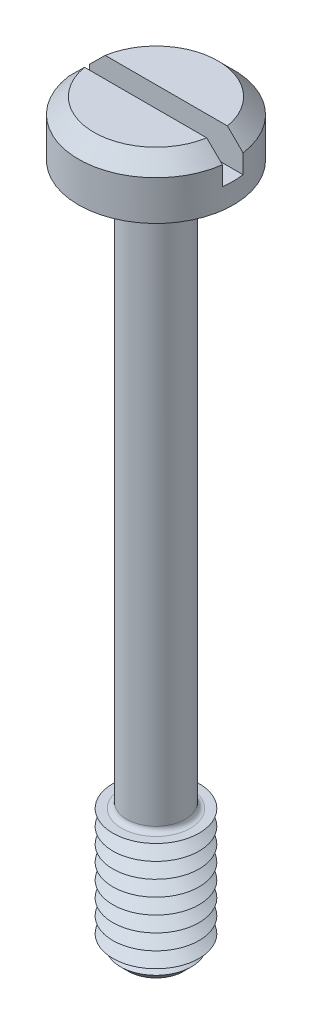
SolidWorks part; units mm, degrees
ref_plane "Front Plane" through (0, 0, 0) normal (0, 0, 1) x (1, 0, 0)
ref_plane "Top Plane" through (0, 0, 0) normal (0, 1, 0) x (1, 0, 0)
ref_plane "Right Plane" through (0, 0, 0) normal (1, 0, 0) x (0, 0, -1)
sketch "Sketch1" plane through (0, 0, 0) normal (0, 1, 0) x (1, 0, 0)
  circle A0 centre (0, 0) radius 2.25
  dimension "D1" = 4.5
extrude "Boss-Extrude1" add sketch "Sketch1" along normal blind 1.6
sketch "Sketch2" plane through (0, 0, 0) normal (0, -1, 0) x (1, 0, 0)
  circle A0 centre (0, 0) radius 0.85
  dimension "D1" = 1.7
extrude "Boss-Extrude2" add sketch "Sketch2" along normal blind 20
sketch "Sketch3" plane through (0, -20, 0) normal (0, -1, 0) x (1, 0, 0)
  circle A0 centre (0, 0) radius 1.25
  dimension "D1" = 2.5
extrude "Boss-Extrude3" add sketch "Sketch3" against normal blind 3.7
chamfer "Chamfer1" distance 0.45 angle 45 1 edges at (0, -20, -1.25)
sketch "Sketch4" plane through (0, 0, 0) normal (1, 0, 0) x (0, 0, -1)
  line L0 (0, -6.5871) -> (0, -12.0372) construction
sketch "Sketch5" plane through (0, 0, 0) normal (1, 0, 0) x (0, 0, -1)
  line L0 (-1.25, -16.3) -> (-0.8603, -16.525)
  line L1 (-0.8603, -16.525) -> (-1.25, -16.75)
  line L2 (-1.25, -16.3) -> (-1.25, -19.55) construction
  line L3 (-1.25, -16.75) -> (-1.25, -16.3)
  dimension "D1" = 0.45
revolve "Cut-Revolve1" cut sketch "Sketch5" angle 360 about L0
pattern_linear "LPattern1" count 8 spacing 0.45 along (0, -1, 0) of "Cut-Revolve1"
fillet "Fillet1" radius 0.15 2 edges at (0, -16.3, -0.85) (0, 0, -0.85)
chamfer "Chamfer2" distance 0.45 angle 45 1 edges at (0, 1.6, 2.25)
sketch "Sketch6" plane through (0, 1.6, 0) normal (0, 1, 0) x (1, 0, 0)
  line L1 (2.25, -0.3) -> (-2.25, -0.3)
  line L2 (2.25, -0.3) -> (2.25, 0.3)
  line L3 (2.25, 0.3) -> (-2.25, 0.3)
  line L4 (-2.25, -0.3) -> (-2.25, 0.3)
  line L5 (2.25, -0.3) -> (-2.25, 0.3) construction
  line L6 (2.25, 0.3) -> (-2.25, -0.3) construction
  circle A0 centre (0, 0) radius 2.25 construction
  point P0 (0, 0)
  dimension "D1" = 0.6
extrude "Cut-Extrude1" cut sketch "Sketch6" against normal blind 1
